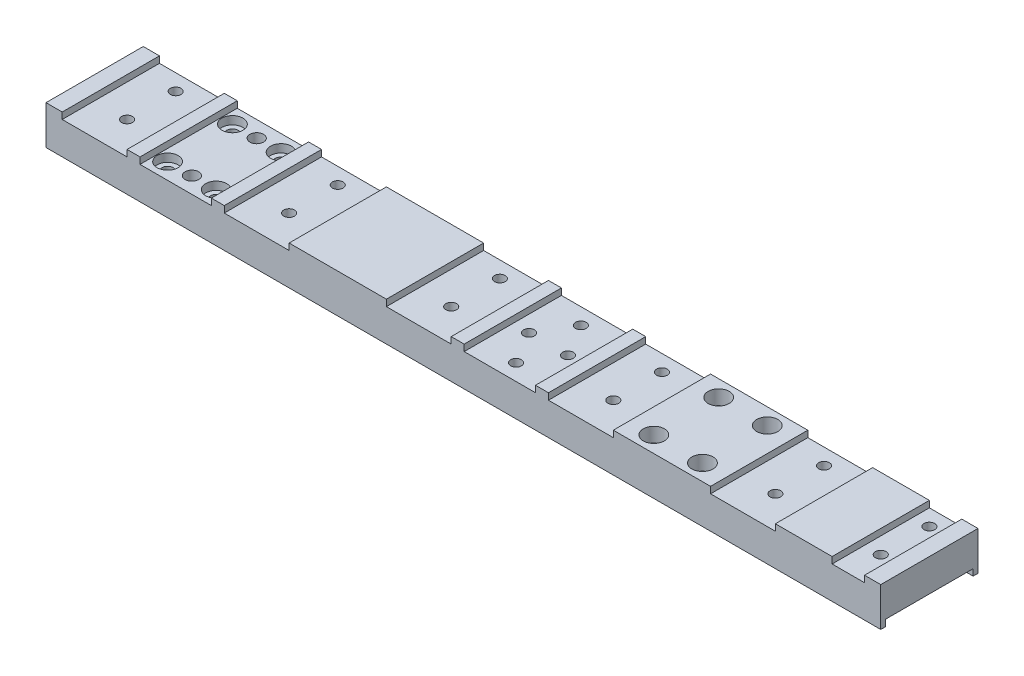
SolidWorks part; units mm, degrees
ref_plane "前视基准面" through (0, 0, 0) normal (0, 0, 1) x (1, 0, 0)
ref_plane "上视基准面" through (0, 0, 0) normal (0, 1, 0) x (1, 0, 0)
ref_plane "右视基准面" through (0, 0, 0) normal (1, 0, 0) x (0, 0, -1)
sketch "草图1" plane through (0, 0, 0) normal (0, 0, 1) x (1, 0, 0)
  line L0 (5, 10) -> (25, 10)
  line L1 (0, 12) -> (5, 12)
  line L2 (0, 0) -> (257.5, 0)
  line L3 (0, 0) -> (0, 12)
  line L4 (257.5, 0) -> (257.5, 12)
  line L5 (5, 12) -> (5, 10)
  line L6 (25, 12) -> (25, 10)
  line L7 (25, 12) -> (29, 12)
  line L8 (75, 12) -> (75, 10)
  line L9 (55, 12) -> (55, 10)
  line L10 (55, 10) -> (75, 10)
  line L11 (125, 12) -> (125, 10)
  line L12 (105, 12) -> (105, 10)
  line L13 (105, 10) -> (125, 10)
  line L14 (175, 12) -> (175, 10)
  line L15 (155, 12) -> (155, 10)
  line L16 (155, 10) -> (175, 10)
  line L17 (225, 12) -> (225, 10)
  line L18 (205, 12) -> (205, 10)
  line L19 (205, 10) -> (225, 10)
  line L20 (75, 12) -> (105, 12)
  line L21 (125, 12) -> (129, 12)
  line L22 (175, 12) -> (205, 12)
  line L23 (225, 12) -> (242.5, 12)
  line L24 (242.5, 10) -> (242.5, 12)
  line L25 (252.5, 12) -> (252.5, 10)
  line L26 (242.5, 10) -> (252.5, 10)
  line L27 (252.5, 12) -> (257.5, 12)
  line L28 (129, 12) -> (129, 10)
  line L29 (151, 12) -> (151, 10)
  line L30 (129, 10) -> (151, 10)
  line L31 (151, 12) -> (155, 12)
  line L32 (29, 12) -> (29, 10)
  line L33 (51, 12) -> (51, 10)
  line L34 (29, 10) -> (51, 10)
  line L35 (51, 12) -> (55, 12)
extrude "凸台-拉伸1" add sketch "草图1" along normal blind 30
sketch "草图2" plane through (257.5, 0, 0) normal (1, 0, 0) x (0, 0, -1)
  line L0 (-28.5, 2) -> (-1.5, 2)
  line L1 (-28.5, 0) -> (-28.5, 2)
  line L2 (-1.5, 0) -> (-1.5, 2)
extrude "切除-拉伸1" cut sketch "草图2" against normal through all and the other way through all
sketch "草图3" plane through (0, 10, 0) normal (0, 1, 0) x (1, 0, 0)
  circle A0 centre (15, -5) radius 1.65
  circle A1 centre (15, -20) radius 1.65
  circle A2 centre (65, -5) radius 1.65
  circle A3 centre (65, -20) radius 1.65
  circle A4 centre (115, -20) radius 1.65
  circle A5 centre (115, -5) radius 1.65
  circle A6 centre (165, -5) radius 1.65
  circle A7 centre (165, -20) radius 1.65
  circle A8 centre (215, -5) radius 1.65
  circle A9 centre (215, -20) radius 1.65
  circle A10 centre (247.5, -20) radius 1.65
  circle A11 centre (247.5, -5) radius 1.65
  circle A12 centre (32.5, -5) radius 1.75
  circle A13 centre (47.5, -5) radius 1.75
  circle A14 centre (47.5, -25) radius 1.75
  circle A15 centre (32.5, -25) radius 1.75
  circle A16 centre (182.5, -5) radius 1.75
  circle A17 centre (197.5, -5) radius 1.75
  circle A18 centre (197.5, -25) radius 1.75
  circle A19 centre (182.5, -25) radius 1.75
  circle A20 centre (140, -5) radius 1.65
  circle A21 centre (140, -25) radius 1.65
  circle A22 centre (40, -5) radius 2.1
  circle A23 centre (40, -25) radius 2.1
  circle A24 centre (134, -15) radius 1.65
  circle A25 centre (146, -15) radius 1.65
extrude "切除-拉伸2" cut sketch "草图3" against normal blind 30
sketch "草图6" plane through (0, 12, 0) normal (0, 1, 0) x (1, 0, 0)
  circle A0 centre (32.5, -5) radius 3.25
  circle A1 centre (47.5, -5) radius 3.25
  circle A2 centre (47.5, -25) radius 3.25
  circle A3 centre (32.5, -25) radius 3.25
  circle A4 centre (182.5, -5) radius 3.25
  circle A5 centre (197.5, -5) radius 3.25
  circle A6 centre (197.5, -25) radius 3.25
  circle A7 centre (182.5, -25) radius 3.25
extrude "切除-拉伸4" cut sketch "草图6" against normal blind 4.5
